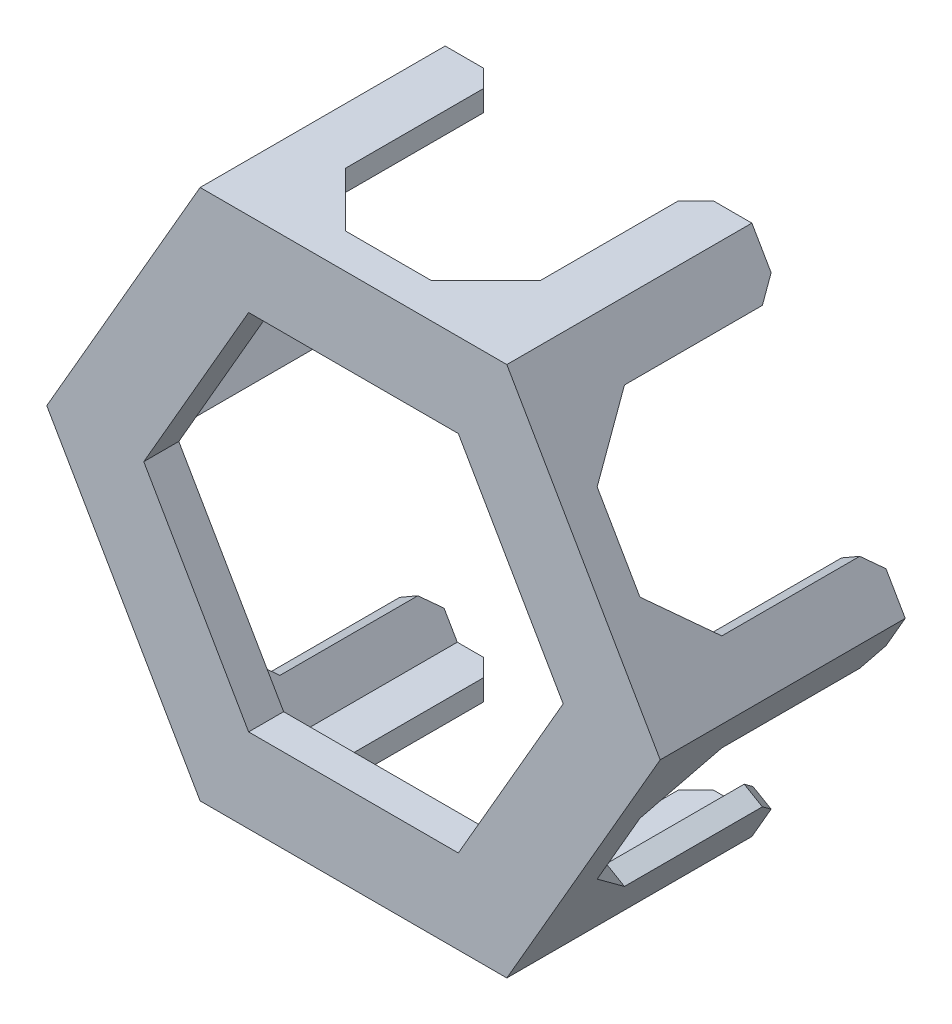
SolidWorks part; units mm, degrees
ref_plane "Alzado" through (0, 0, 0) normal (0, 0, 1) x (1, 0, 0)
ref_plane "Planta" through (0, 0, 0) normal (0, 1, 0) x (1, 0, 0)
ref_plane "Vista lateral" through (0, 0, 0) normal (1, 0, 0) x (0, 0, -1)
sketch "Croquis1" plane through (0, 0, 0) normal (0, 0, 1) x (1, 0, 0)
  line L0 (20, -34.641) -> (-20, -34.641) construction
  line L1 (40, 0) -> (20, -34.641) construction
  line L2 (-20, -34.641) -> (-40, 0) construction
  line L3 (-40, 0) -> (-20, 34.641) construction
  line L4 (20, 34.641) -> (40, 0) construction
  line L5 (-20, 34.641) -> (20, 34.641) construction
  line L6 (40, 0) -> (20, -34.641) construction
  line L7 (20, -34.641) -> (-20, -34.641) construction
  line L8 (-20, -34.641) -> (-40, 0) construction
  line L9 (-40, 0) -> (-20, 34.641) construction
  line L10 (20, 34.641) -> (40, 0) construction
  line L11 (-20, 34.641) -> (20, 34.641) construction
  line L12 (20.1732, -34.941) -> (-20.1732, -34.941)
  line L13 (-20.1732, -34.941) -> (-40.3464, 0)
  line L14 (-40.3464, 0) -> (-20.1732, 34.941)
  line L15 (-20.1732, 34.941) -> (20.1732, 34.941)
  line L16 (20.1732, 34.941) -> (40.3464, 0)
  line L17 (40.3464, 0) -> (20.1732, -34.941)
  line L18 (21.9053, -37.941) -> (-21.9053, -37.941)
  line L19 (-21.9053, -37.941) -> (-43.8105, 0)
  line L20 (-43.8105, 0) -> (-21.9053, 37.941)
  line L21 (-21.9053, 37.941) -> (21.9053, 37.941)
  line L22 (21.9053, 37.941) -> (43.8105, 0)
  line L23 (43.8105, 0) -> (21.9053, -37.941)
  line L24 (29.9541, 0) -> (14.9771, -25.941)
  line L25 (14.9771, -25.941) -> (-14.9771, -25.941)
  line L26 (-14.9771, -25.941) -> (-29.9541, 0)
  line L27 (-29.9541, 0) -> (-14.9771, 25.941)
  line L28 (-14.9771, 25.941) -> (14.9771, 25.941)
  line L29 (14.9771, 25.941) -> (29.9541, 0)
  dimension "D1" = 0.3
  dimension "D2" = 3
  dimension "D3" = 12
extrude "Saliente-Extruir1" add sketch "Croquis1" along normal blind 5 contours L23 L22 L21 L20 L19 L18 L16 L17 L12 L13 L14 L15 | L17 L16 L15 L14 L13 L12 L28 L29 L24 L25 L26 L27
sketch "Croquis2" plane through (0, 0, 0) normal (0, 0, -1) x (-1, 0, 0)
  line L0 (-43.8105, 0) -> (-40.3464, 0) construction
  line L1 (-39.8105, -6.9282) -> (-37.2124, -5.4282)
  line L2 (-43.8105, 0) -> (-21.9053, -37.941) construction
  line L3 (-40.3464, 0) -> (-20.1732, -34.941) construction
  line L4 (-40.3464, 0) -> (-37.2124, -5.4282)
  line L5 (-43.8105, 0) -> (-39.8105, -6.9282)
  line L6 (-40.3464, 0) -> (-37.2124, 5.4282)
  line L7 (-39.8105, 6.9282) -> (-37.2124, 5.4282)
  line L8 (-43.8105, 0) -> (-39.8105, 6.9282)
  point P10 (0, 0)
  dimension "D1" = 8
extrude "Saliente-Extruir2" add sketch "Croquis2" along normal blind 30
sketch3d "Croquis3D1"
  line L0 (0, 0, 0) -> (0, 0, 5) construction
  line L1 (0, -37.941, 0) -> (0, 37.941, 0) construction
  line L2 (21.9053, -37.941, 0) -> (-21.9053, -37.941, 0) construction
  line L3 (-21.9053, 37.941, 0) -> (21.9053, 37.941, 0) construction
  line L4 (0, -37.941, 5) -> (0, 37.941, 5) construction
  line L5 (21.9053, -37.941, 5) -> (-21.9053, -37.941, 5) construction
  line L6 (-21.9053, 37.941, 5) -> (21.9053, 37.941, 5) construction
  point P18 (0, 0, 5)
fillet "Redondeo1" radius 7.8 2 edges at (38.5115, 6.1782, 0) (38.5115, -6.1782, 0)
fillet "Redondeo2" radius 2.5 2 edges at (38.5115, 6.1782, -30) (38.5115, -6.1782, -30)
pattern_circular "MatrizC1" count 6 over 360 about axis through (0, 0, 0) along (0, 0, 1) of "Saliente-Extruir2", "Redondeo1", "Redondeo2"
